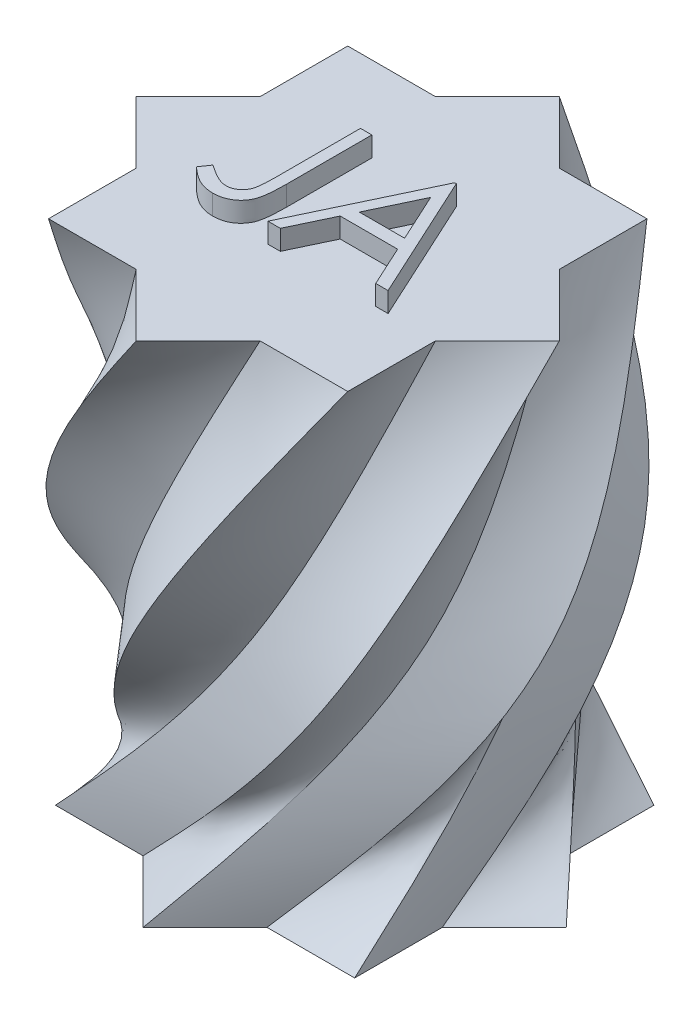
SolidWorks part; units mm, degrees
ref_plane "Alzado" through (0, 0, 0) normal (0, 0, 1) x (1, 0, 0)
ref_plane "Planta" through (0, 0, 0) normal (0, 1, 0) x (1, 0, 0)
ref_plane "Vista lateral" through (0, 0, 0) normal (1, 0, 0) x (0, 0, -1)
sketch "Croquis1" plane through (0, 0, 0) normal (0, 1, 0) x (1, 0, 0)
  line L0 (0, 21.2132) -> (-6.2132, 15)
  line L5 (-21.2132, 0) -> (-15, -6.2132)
  line L6 (0, -21.2132) -> (6.2132, -15)
  line L7 (21.2132, 0) -> (15, 6.2132)
  line L8 (-15, 15) -> (-15, 6.2132)
  line L9 (-15, -15) -> (-6.2132, -15)
  line L10 (15, -15) -> (15, -6.2132)
  line L11 (15, 15) -> (6.2132, 15)
  line L12 (-6.2132, 15) -> (-15, 15)
  line L13 (6.2132, 15) -> (0, 21.2132)
  line L14 (15, 6.2132) -> (15, 15)
  line L15 (15, -6.2132) -> (21.2132, 0)
  line L16 (6.2132, -15) -> (15, -15)
  line L17 (-6.2132, -15) -> (0, -21.2132)
  line L18 (-15, -6.2132) -> (-15, -15)
  line L19 (-15, 6.2132) -> (-21.2132, 0)
  line L20 (2.2606, -109.5383) -> (-3.9526, -115.7515)
  line L21 (-18.9526, -130.7515) -> (-12.7394, -136.9647)
  line L22 (2.2606, -151.9647) -> (8.4738, -145.7515)
  line L23 (23.4738, -130.7515) -> (17.2606, -124.5383)
  line L24 (-12.7394, -115.7515) -> (-12.7394, -124.5383)
  line L25 (-12.7394, -145.7515) -> (-3.9526, -145.7515)
  line L26 (17.2606, -145.7515) -> (17.2606, -136.9647)
  line L27 (17.2606, -115.7515) -> (8.4738, -115.7515)
  line L28 (-3.9526, -115.7515) -> (-12.7394, -115.7515)
  line L29 (8.4738, -115.7515) -> (2.2606, -109.5383)
  line L30 (17.2606, -124.5383) -> (17.2606, -115.7515)
  line L31 (17.2606, -136.9647) -> (23.4738, -130.7515)
  line L32 (8.4738, -145.7515) -> (17.2606, -145.7515)
  line L33 (-3.9526, -145.7515) -> (2.2606, -151.9647)
  line L34 (-12.7394, -136.9647) -> (-12.7394, -145.7515)
  line L35 (-12.7394, -124.5383) -> (-18.9526, -130.7515)
  dimension "D2" = 30
  dimension "D3" = 30
  dimension "D4" = 30
  dimension "D5" = 30
  dimension "D6" = 30
  dimension "D11" = 30
  dimension "D12" = 30
  dimension "D13" = 30
ref_plane "Plano1" through (0, 25, 0) normal (0, 1, 0) x (1, 0, 0)
ref_plane "Plano2" through (0, 50, 0) normal (0, 1, 0) x (1, 0, 0)
sketch "Croquis2" plane through (0, 25, 0) normal (0, 1, 0) x (1, 0, 0)
  line L0 (-1.2769, 21.7962) -> (-7.4901, 15.583)
  line L1 (-22.4901, 0.583) -> (-16.2769, -5.6302)
  line L2 (-1.2769, -20.6302) -> (4.9363, -14.417)
  line L3 (19.9363, 0.583) -> (13.7231, 6.7962)
  line L4 (-16.2769, 15.583) -> (-16.2769, 6.7962)
  line L5 (-16.2769, -14.417) -> (-7.4901, -14.417)
  line L6 (13.7231, -14.417) -> (13.7231, -5.6302)
  line L7 (13.7231, 15.583) -> (4.9363, 15.583)
  line L8 (-7.4901, 15.583) -> (-16.2769, 15.583)
  line L9 (4.9363, 15.583) -> (-1.2769, 21.7962)
  line L10 (13.7231, 6.7962) -> (13.7231, 15.583)
  line L11 (13.7231, -5.6302) -> (19.9363, 0.583)
  line L12 (4.9363, -14.417) -> (13.7231, -14.417)
  line L13 (-7.4901, -14.417) -> (-1.2769, -20.6302)
  line L14 (-16.2769, -5.6302) -> (-16.2769, -14.417)
  line L15 (-16.2769, 6.7962) -> (-22.4901, 0.583)
  line L16 (0.9837, -108.9553) -> (-5.2295, -115.1685)
  line L17 (-20.2295, -130.1685) -> (-14.0163, -136.3817)
  line L18 (0.9837, -151.3817) -> (7.1969, -145.1685)
  line L19 (22.1969, -130.1685) -> (15.9837, -123.9553)
  line L20 (-14.0163, -115.1685) -> (-14.0163, -123.9553)
  line L21 (-14.0163, -145.1685) -> (-5.2295, -145.1685)
  line L22 (15.9837, -145.1685) -> (15.9837, -136.3817)
  line L23 (15.9837, -115.1685) -> (7.1969, -115.1685)
  line L24 (-5.2295, -115.1685) -> (-14.0163, -115.1685)
  line L25 (7.1969, -115.1685) -> (0.9837, -108.9553)
  line L26 (15.9837, -123.9553) -> (15.9837, -115.1685)
  line L27 (15.9837, -136.3817) -> (22.1969, -130.1685)
  line L28 (7.1969, -145.1685) -> (15.9837, -145.1685)
  line L29 (-5.2295, -145.1685) -> (0.9837, -151.3817)
  line L30 (-14.0163, -136.3817) -> (-14.0163, -145.1685)
  line L31 (-14.0163, -123.9553) -> (-20.2295, -130.1685)
  dimension "D1" = 30
  dimension "D2" = 30
  dimension "D3" = 30
  dimension "D4" = 30
  dimension "D10" = 30
  dimension "D11" = 30
  dimension "D12" = 30
  dimension "D13" = 30
sketch "Croquis3" plane through (0, 50, 0) normal (0, 1, 0) x (1, 0, 0)
  line L0 (-1.2769, 21.7962) -> (-7.4901, 15.583)
  line L1 (-22.4901, 0.583) -> (-16.2769, -5.6302)
  line L2 (-1.2769, -20.6302) -> (4.9363, -14.417)
  line L3 (19.9363, 0.583) -> (13.7231, 6.7962)
  line L4 (-16.2769, 15.583) -> (-16.2769, 6.7962)
  line L5 (-16.2769, -14.417) -> (-7.4901, -14.417)
  line L6 (13.7231, -14.417) -> (13.7231, -5.6302)
  line L7 (13.7231, 15.583) -> (4.9363, 15.583)
  line L8 (-7.4901, 15.583) -> (-16.2769, 15.583)
  line L9 (4.9363, 15.583) -> (-1.2769, 21.7962)
  line L10 (13.7231, 6.7962) -> (13.7231, 15.583)
  line L11 (13.7231, -5.6302) -> (19.9363, 0.583)
  line L12 (4.9363, -14.417) -> (13.7231, -14.417)
  line L13 (-7.4901, -14.417) -> (-1.2769, -20.6302)
  line L14 (-16.2769, -5.6302) -> (-16.2769, -14.417)
  line L15 (-16.2769, 6.7962) -> (-22.4901, 0.583)
  line L16 (0.9837, -108.9553) -> (-5.2295, -115.1685)
  line L17 (-20.2295, -130.1685) -> (-14.0163, -136.3817)
  line L18 (0.9837, -151.3817) -> (7.1969, -145.1685)
  line L19 (22.1969, -130.1685) -> (15.9837, -123.9553)
  line L20 (-14.0163, -115.1685) -> (-14.0163, -123.9553)
  line L21 (-14.0163, -145.1685) -> (-5.2295, -145.1685)
  line L22 (15.9837, -145.1685) -> (15.9837, -136.3817)
  line L23 (15.9837, -115.1685) -> (7.1969, -115.1685)
  line L24 (-5.2295, -115.1685) -> (-14.0163, -115.1685)
  line L25 (7.1969, -115.1685) -> (0.9837, -108.9553)
  line L26 (15.9837, -123.9553) -> (15.9837, -115.1685)
  line L27 (15.9837, -136.3817) -> (22.1969, -130.1685)
  line L28 (7.1969, -145.1685) -> (15.9837, -145.1685)
  line L29 (-5.2295, -145.1685) -> (0.9837, -151.3817)
  line L30 (-14.0163, -136.3817) -> (-14.0163, -145.1685)
  line L31 (-14.0163, -123.9553) -> (-20.2295, -130.1685)
  dimension "D1" = 30
  dimension "D2" = 30
  dimension "D3" = 30
  dimension "D4" = 30
  dimension "D10" = 30
  dimension "D11" = 30
  dimension "D12" = 30
  dimension "D13" = 30
other "Límite1"
sketch "Croquis4" plane through (0, 0, 0) normal (0, -1, 0) x (1, 0, 0)
  circle A0 centre (0, 0) radius 5
  dimension "D1" = 10
extrude "Cortar-Extruir1" cut sketch "Croquis4" against normal blind 20
sketch "Croquis5" plane through (0, 25, 0) normal (0, 1, 0) x (1, 0, 0)
  circle A0 centre (0, 0) radius 10.1652
sketch "Croquis6" plane through (0, 50, 0) normal (0, 1, 0) x (1, 0, 0)
  text T0 "JA" font "Century Gothic" height in points 48
extrude "Saliente-Extruir1" add sketch "Croquis6" along normal blind 2
shell "Vaciado1" thickness 1
